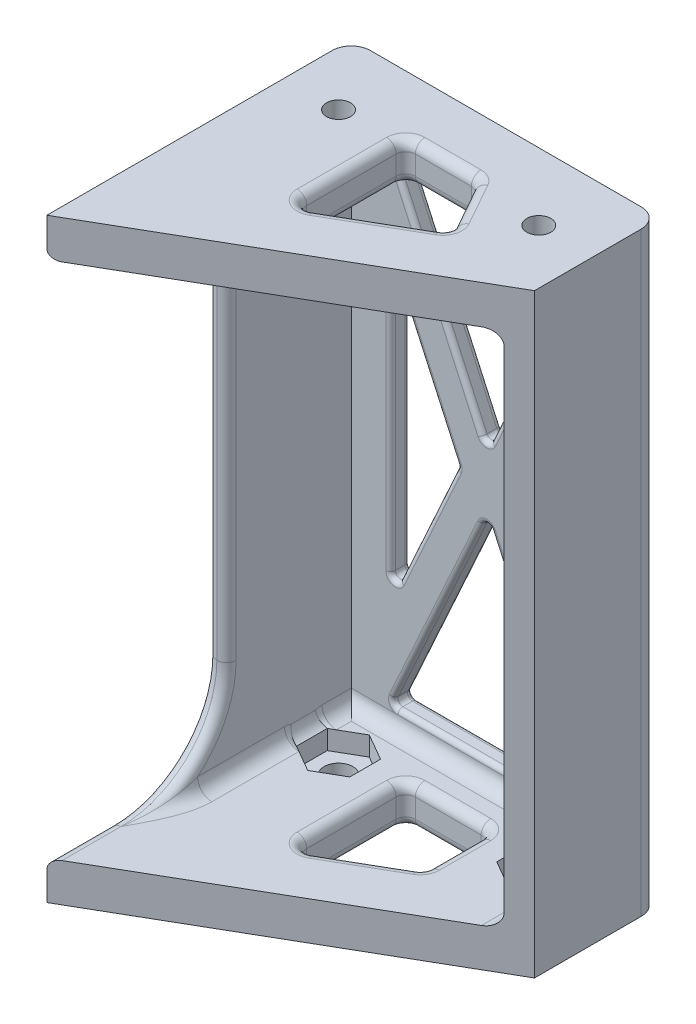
SolidWorks part; units mm, degrees
ref_plane "Front Plane" through (0, 0, 0) normal (0, 0, 1) x (1, 0, 0)
ref_plane "Top Plane" through (0, 0, 0) normal (0, 1, 0) x (1, 0, 0)
ref_plane "Right Plane" through (0, 0, 0) normal (1, 0, 0) x (0, 0, -1)
sketch "Sketch1" plane through (0, 0, 0) normal (0, 1, 0) x (1, 0, 0)
  line L1 (0, 0) -> (32.2, 0)
  line L2 (0, 0) -> (0, 34.25)
  line L3 (0, 34.25) -> (32.2, 34.25)
  line L4 (32.2, 0) -> (32.2, 34.25)
  dimension "D1" = 34.25
  dimension "D2" = 32.2
extrude "Boss-Extrude1" add sketch "Sketch1" along normal blind 4
sketch "Sketch2" plane through (0, 4, 0) normal (0, 1, 0) x (1, 0, 0)
  line L0 (32.2, 34.25) -> (0, 34.25) construction
  line L3 (16.1, 27.25) -> (5.67, 27.25) construction
  line L4 (16.1, 27.25) -> (26.53, 27.25) construction
  line L5 (16.1, 34.25) -> (16.1, 0) construction
  line L6 (0, 0) -> (32.2, 0) construction
  dimension "D1" = 10.43
  dimension "D2" = 7
ref_plane "Plane1" through (0, 58, 0) normal (0, 1, 0) x (1, 0, 0)
sketch "Sketch5" plane through (0, 58, 0) normal (0, 1, 0) x (1, 0, 0)
  line L1 (0, 34.25) -> (32.2, 34.25)
  line L2 (0, 34.25) -> (0, 0)
  line L3 (0, 0) -> (32.2, 0)
  line L4 (32.2, 34.25) -> (32.2, 0)
  dimension "D1" = 34.25
extrude "Boss-Extrude2" add sketch "Sketch5" along normal blind 4 separate body
sketch "Sketch6" plane through (0, 62, 0) normal (0, 1, 0) x (1, 0, 0)
  line L0 (16.1, 34.25) -> (16.1, 0) construction
  line L1 (32.2, 34.25) -> (0, 34.25) construction
  line L2 (0, 0) -> (32.2, 0) construction
  line L3 (16.1, 27.25) -> (5.67, 27.25) construction
  line L4 (16.1, 27.25) -> (26.53, 27.25) construction
  dimension "D1" = 10.43
  dimension "D2" = 7
sketch "Sketch11" plane through (0, 0, 0) normal (-1, 0, 0) x (0, 0, 1)
  line L0 (-34.25, 4) -> (-34.25, 58)
  line L1 (-34.25, 58) -> (0, 58)
  line L2 (0, 58) -> (0, 4)
  line L3 (0, 4) -> (-34.25, 4)
  line L4 (-34.25, 31) -> (0, 31) construction
extrude "Boss-Extrude3" add sketch "Sketch11" against normal blind 2
sketch "Sketch24" plane through (0, 0, 0) normal (0, -1, 0) x (1, 0, 0)
  line L0 (16.1, -34.25) -> (16.1, 71.9) construction
  line L1 (108.0286, 41.2361) -> (-3.3086, -23.0444)
  line L2 (108.0286, 18.825) -> (108.0286, 124.975) construction
  line L3 (108.0286, 124.975) -> (16.1, 178.05) construction
  line L4 (16.1, 178.05) -> (-75.8286, 124.975) construction
  line L5 (-75.8286, 124.975) -> (-75.8286, 18.825) construction
  line L6 (-75.8286, 18.825) -> (16.1, -34.25) construction
  line L7 (16.1, -34.25) -> (108.0286, 18.825) construction
  line L8 (-3.3086, -23.0444) -> (-39.5686, 39.7597)
  line L9 (108.0286, 41.2361) -> (71.7686, 104.0403)
  line L10 (-39.5686, 39.7597) -> (71.7686, 104.0403)
  circle A0 centre (16.1, 71.9) radius 91.9286 construction
  dimension "D1" = 106.15
  dimension "D2" = 72.52
extrude "Cut-Extrude6" cut sketch "Sketch24" against normal through all
sketch "Sketch26" plane through (32.2, 0, 0) normal (1, 0, 0) x (0, 0, -1)
  line L0 (34.25, 4) -> (34.25, 58)
  line L1 (34.25, 58) -> (2.5435, 58)
  line L2 (2.5435, 58) -> (2.5435, 4)
  line L3 (2.5435, 4) -> (34.25, 4)
extrude "Boss-Extrude5" add sketch "Sketch26" against normal blind 2
sketch "Sketch27" plane through (0, 58, 0) normal (0, 1, 0) x (1, 0, 0)
  line L3 (32.2, 2.5435) -> (30.2, 3.6982)
  line L4 (30.2, 3.6982) -> (30.2, 2.5435)
  line L5 (30.2, 2.5435) -> (32.2, 2.5435)
  line L6 (32.2, 2.5435) -> (30.2, 3.6982)
  line L7 (30.2, 3.6982) -> (30.2, 2.5435)
  line L8 (30.2, 2.5435) -> (32.2, 2.5435)
  dimension "D1" = 0
extrude "Cut-Extrude7" cut sketch "Sketch27" against normal through all
sketch "Sketch28" plane through (32.2, 0, 0) normal (1, 0, 0) x (0, 0, -1)
  line L3 (2.5435, 62) -> (2.5435, 0) construction
  line L7 (19.25, 4) -> (19.25, 58)
  line L8 (19.25, 58) -> (2.5435, 58)
  line L9 (2.5435, 62) -> (34.25, 62) construction
  line L10 (34.25, 0) -> (34.25, 62) construction
  line L11 (2.5435, 0) -> (34.25, 0) construction
  line L12 (19.25, 4) -> (2.5435, 4)
  line L13 (2.5435, 4) -> (2.5435, 58)
  dimension "D1" = 4
  dimension "D4" = 4
  dimension "D6" = 15
extrude "Cut-Extrude8" cut sketch "Sketch28" against normal up to next
sketch "Sketch29" plane through (0, 62, 0) normal (0, 1, 0) x (1, 0, 0)
  line L0 (20.53, 16.2094) -> (9.824, 22.3905)
  line L1 (9.824, 22.3905) -> (13.1097, 28.25)
  line L2 (13.1097, 28.25) -> (20.53, 28.25)
  line L3 (20.53, 28.25) -> (20.53, 16.2094)
  line L4 (32.2, 2.5435) -> (0, 21.1342) construction
  line L5 (32.2, 34.25) -> (0, 34.25) construction
  dimension "D1" = 6
  dimension "D2" = 6
  dimension "D3" = 6
  dimension "D4" = 6
extrude "Cut-Extrude9" cut sketch "Sketch29" against normal up to next
sketch "Sketch30" plane through (0, 4, 0) normal (0, 1, 0) x (1, 0, 0)
  line L0 (20.53, 28.25) -> (20.53, 16.2094)
  line L1 (20.53, 16.2094) -> (11.67, 21.3247)
  line L2 (11.67, 21.3247) -> (11.67, 28.25)
  line L3 (20.53, 28.25) -> (11.67, 28.25)
  line L4 (2, 19.9795) -> (32.2, 2.5435) construction
  line L5 (30.2, 34.25) -> (2, 34.25) construction
  dimension "D1" = 6
  dimension "D2" = 6
  dimension "D3" = 6
  dimension "D4" = 6
extrude "Cut-Extrude10" cut sketch "Sketch30" against normal up to next
fillet "Fillet1" radius 1 24 edges at (16.8199, 58, -28.25) (16.8199, 62, -28.25) (15.177, 62, -19.3) (15.177, 58, -19.3) (11.4669, 62, -25.3203) (11.4669, 58, -25.3203) (20.53, 62, -22.2297) (20.53, 58, -22.2297) (11.67, 0, -24.7874) (11.67, 4, -24.7874) (16.1, 0, -28.25) (16.1, 4, -28.25) (16.1, 0, -18.7671) (16.1, 4, -18.7671) (20.53, 0, -22.2297) (20.53, 4, -22.2297) (11.67, 2, -28.25) (11.67, 2, -21.3247) (20.53, 2, -28.25) (20.53, 2, -16.2094) (9.824, 60, -22.3905) (13.1097, 60, -28.25) (20.53, 60, -28.25) (20.53, 60, -16.2094)
fillet "Fillet2" radius 2 2 edges at (32.2, 31, -34.25) (0, 31, -34.25)
sketch "Sketch31" plane through (2, 0, 0) normal (1, 0, 0) x (0, 0, -1)
  line L0 (34.25, 4) -> (34.25, 58)
  line L1 (34.25, 58) -> (32.25, 58)
  line L2 (19.9795, 58) -> (34.25, 58) construction
  line L3 (32.25, 58) -> (32.25, 4)
  line L4 (34.25, 4) -> (19.9795, 4) construction
  line L5 (32.25, 4) -> (34.25, 4)
  dimension "D1" = 2
extrude "Boss-Extrude6" add sketch "Sketch31" along normal up to next
sketch "Sketch32" plane through (0, 0, -34.25) normal (0, 0, -1) x (-1, 0, 0)
  line L0 (-16.1, 62) -> (-16.1, 0) construction
  line L1 (-30.2, 62) -> (-2, 62) construction
  line L2 (-30.2, 0) -> (-2, 0) construction
  line L3 (-32.2, 31) -> (0, 31) construction
  line L4 (-32.2, 0) -> (-32.2, 62) construction
  line L5 (0, 62) -> (0, 0) construction
  line L6 (-6.0935, 56) -> (-26.1065, 56)
  line L7 (-26.1065, 56) -> (-16.1, 34)
  line L9 (-30.2, 62) -> (-2, 0) construction
  line L10 (-6.0935, 56) -> (-16.1, 34)
  line L11 (-6.0935, 6) -> (-16.1, 28)
  line L12 (-6.0935, 6) -> (-26.1065, 6)
  line L13 (-26.1065, 6) -> (-16.1, 28)
  line L14 (-6.0935, 46.4043) -> (-6.0935, 15.5957)
  line L15 (-6.0935, 46.4043) -> (-13.1, 31)
  line L17 (-6.0935, 15.5957) -> (-13.1, 31)
  line L18 (-26.1065, 46.4043) -> (-26.1065, 15.5957)
  line L19 (-26.1065, 46.4043) -> (-19.1, 31)
  line L20 (-26.1065, 15.5957) -> (-19.1, 31)
  point P14 (-16.1, 31)
  point P29 (-6.0935, 31)
  dimension "D1" = 6
  dimension "D2" = 3
  dimension "D3" = 3
extrude "Cut-Extrude11" cut sketch "Sketch32" against normal up to next
fillet "Fillet3" radius 0.5 36 edges at (9.5968, 38.7021, -32.25) (9.5968, 38.7021, -34.25) (9.5968, 23.2979, -34.25) (9.5968, 23.2979, -32.25) (22.6032, 23.2979, -32.25) (22.6032, 23.2979, -34.25) (22.6032, 38.7021, -34.25) (22.6032, 38.7021, -32.25) (21.1032, 45, -32.25) (21.1032, 45, -34.25) (11.0968, 45, -34.25) (11.0968, 45, -32.25) (11.0968, 17, -32.25) (11.0968, 17, -34.25) (21.1032, 17, -34.25) (21.1032, 17, -32.25) (6.0935, 46.4043, -33.25) (6.0935, 31, -34.25) (6.0935, 15.5957, -33.25) (6.0935, 31, -32.25) (26.1065, 15.5957, -33.25) (26.1065, 31, -34.25) (26.1065, 46.4043, -33.25) (26.1065, 31, -32.25) (26.1065, 56, -33.25) (16.1, 56, -34.25) (6.0935, 56, -33.25) (16.1, 56, -32.25) (6.0935, 6, -33.25) (16.1, 6, -34.25) (26.1065, 6, -33.25) (16.1, 6, -32.25) (19.1, 31, -33.25) (13.1, 31, -33.25) (16.1, 34, -33.25) (16.1, 28, -33.25)
fillet "Fillet4" radius 10 2 edges at (31.2, 58, -19.25) (31.2, 4, -19.25)
fillet "Fillet5" radius 1 8 edges at (32.2, 58, -5.8968) (32.2, 55.0711, -16.3211) (32.2, 31, -19.25) (32.2, 6.9289, -16.3211) (32.2, 4, -5.8968) (30.2, 55.0711, -16.3211) (30.2, 31, -19.25) (30.2, 6.9289, -16.3211)
sketch "Sketch35" plane through (0, 4, 0) normal (0, 1, 0) x (1, 0, 0)
  line L0 (30.2, 13.8326) -> (30.2, 32.25) construction
  line L1 (8.445, 28.8521) -> (5.67, 30.4543)
  line L2 (5.67, 30.4543) -> (2.895, 28.8521)
  line L3 (2.895, 28.8521) -> (2.895, 25.6479)
  line L4 (2.895, 25.6479) -> (5.67, 24.0457)
  line L5 (5.67, 24.0457) -> (8.445, 25.6479)
  line L6 (8.445, 25.6479) -> (8.445, 28.8521)
  line L7 (23.755, 25.6479) -> (26.53, 24.0457)
  line L8 (26.53, 24.0457) -> (29.305, 25.6479)
  line L9 (29.305, 25.6479) -> (29.305, 28.8521)
  line L10 (29.305, 28.8521) -> (26.53, 30.4543)
  line L11 (26.53, 30.4543) -> (23.755, 28.8521)
  line L12 (23.755, 28.8521) -> (23.755, 25.6479)
  line L13 (2, 32.25) -> (2, 19.9795) construction
  circle A0 centre (5.67, 27.25) radius 2.775 construction
  circle A1 centre (26.53, 27.25) radius 2.775 construction
  dimension "D1" = 5.55
extrude "Cut-Extrude14" cut sketch "Sketch35" against normal blind 2
fillet "Fillet6" radius 1.5 8 edges at (30.4594, 58, -11.8326) (30.4594, 4, -11.8326) (2, 4, -26.1148) (2, 58, -26.1148) (16.1, 58, -32.25) (16.1, 4, -32.25) (30.2, 58, -23.0413) (30.2, 4, -23.0413)
sketch "Sketch36" plane through (0, 4, 0) normal (0, 1, 0) x (1, 0, 0)
  circle A0 centre (5.67, 27.25) radius 1.5
  circle A2 centre (26.53, 27.25) radius 1.5
  dimension "D1" = 3
extrude "Cut-Extrude15" cut sketch "Sketch36" against normal blind 10
sketch "Sketch37" plane through (0, 62, 0) normal (0, 1, 0) x (1, 0, 0)
  circle A0 centre (5.67, 27.25) radius 1.25
  circle A1 centre (26.53, 27.25) radius 1.25
  dimension "D1" = 2.5
extrude "Cut-Extrude16" cut sketch "Sketch37" against normal up to next
mirror "Mirror1" about plane through (32.2, 4, 0) normal (-1, 0, 0)
sketch "Sketch38" plane through (0, 62, 0) normal (0, 1, 0) x (1, 0, 0)
  line L1 (32.2, 2.5435) -> (-6.0851, 2.5435)
  line L2 (32.2, 2.5435) -> (32.2, 40.356)
  line L3 (32.2, 40.356) -> (-6.0851, 40.356)
  line L4 (-6.0851, 2.5435) -> (-6.0851, 40.356)
extrude "Cut-Extrude17" cut sketch "Sketch38" against normal through all
